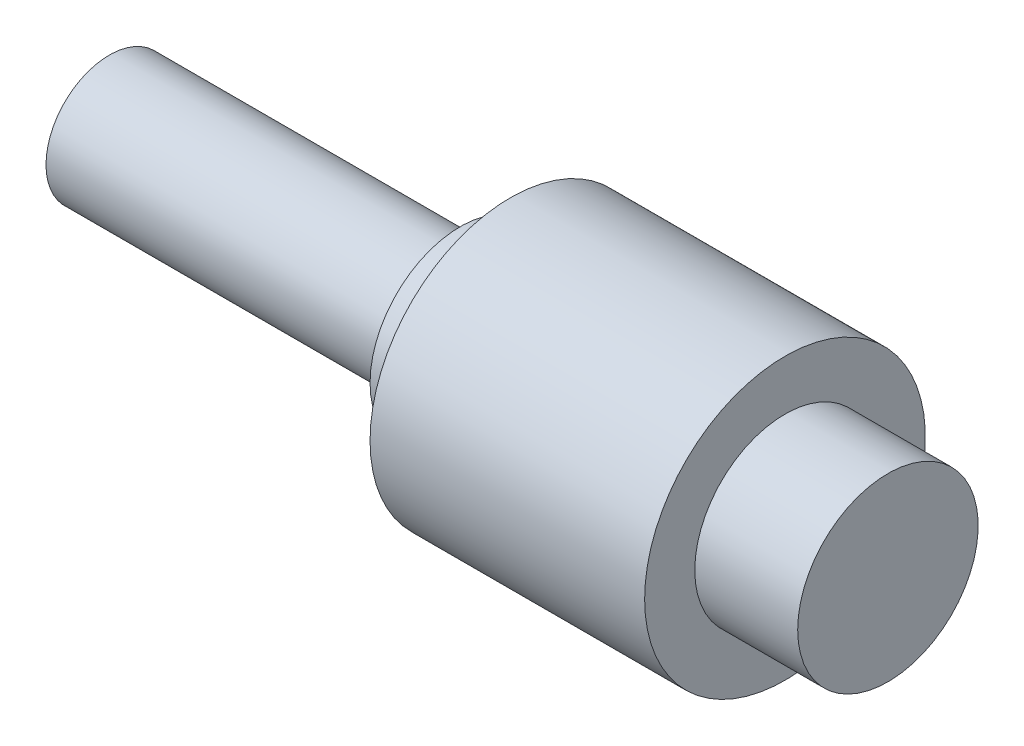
SolidWorks part; units mm, degrees
ref_plane "Front Plane" through (0, 0, 0) normal (0, 0, 1) x (1, 0, 0)
ref_plane "Top Plane" through (0, 0, 0) normal (0, 1, 0) x (1, 0, 0)
ref_plane "Right Plane" through (0, 0, 0) normal (1, 0, 0) x (0, 0, -1)
sketch "Sketch3" plane through (0, 0, 0) normal (0, 0, 1) x (1, 0, 0)
  line L0 (29.734, 9) -> (40, 9)
  line L1 (0, 0) -> (40, 0)
  line L2 (-2.6518, 6.3192) -> (-2.6518, 9)
  line L3 (-2.6518, 9) -> (2.3482, 9)
  line L4 (40, 0) -> (40, 9)
  line L5 (2.3482, 14) -> (29.734, 14)
  line L6 (2.3482, 14) -> (2.3482, 9)
  line L7 (5.5293, 0) -> (32.3858, 0)
  line L8 (29.734, 14) -> (29.734, 9)
  line L10 (-37.6518, 6.3192) -> (-2.6518, 6.3192)
  line L11 (-37.6518, 6.3192) -> (-37.6518, 0)
  line L12 (-37.6518, 0) -> (40, 0)
  line L13 (40, 6) -> (40, 0)
  point P15 (-30.0161, 6.3192)
  point P16 (-37.6518, 6.3192)
revolve "Revolve1" add sketch "Sketch3" angle 360 about L12
